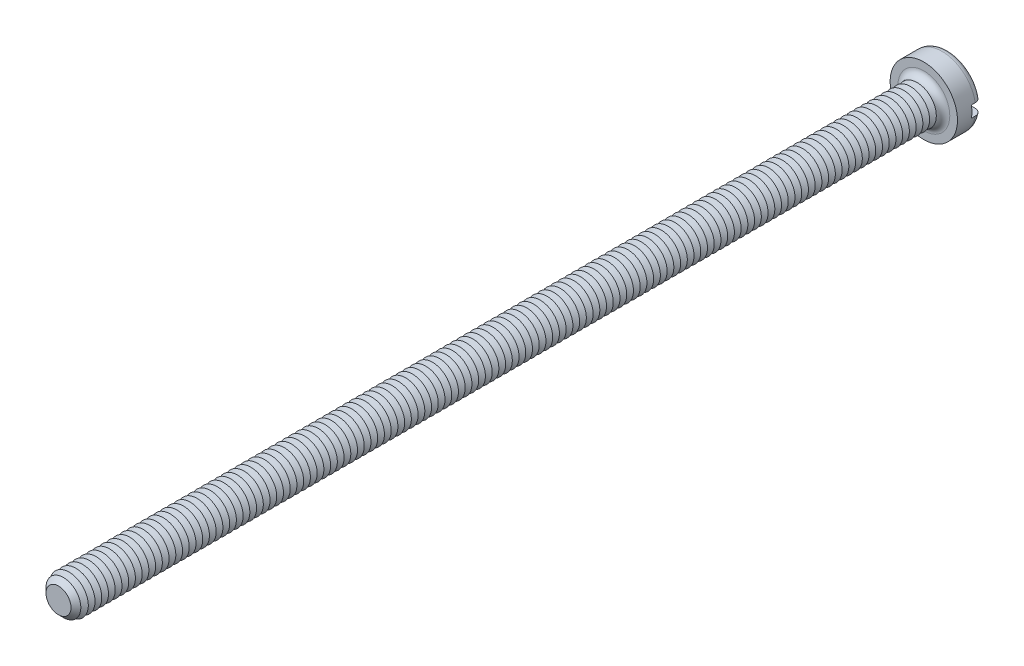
SolidWorks part; units mm, degrees
ref_plane "Front Plane" through (0, 0, 0) normal (0, 0, 1) x (1, 0, 0)
ref_plane "Top Plane" through (0, 0, 0) normal (0, 1, 0) x (1, 0, 0)
ref_plane "Right Plane" through (0, 0, 0) normal (1, 0, 0) x (0, 0, -1)
sketch "Sketch3" plane through (0, 0, 0) normal (0, 0, 1) x (1, 0, 0)
  circle A0 centre (0, 0) radius 3.5
  dimension "D1" = 7
extrude "Boss-Extrude2" add sketch "Sketch3" against normal blind 2.6
sketch "Sketch4" plane through (0, 0, 0) normal (0, 0, 1) x (1, 0, 0)
  circle A0 centre (0, 0) radius 2
  dimension "D1" = 4
extrude "Boss-Extrude3" add sketch "Sketch4" along normal blind 90
fillet "Fillet1" radius 0.7 2 edges at (3.5, 0, -2.6) (2, 0, 0)
chamfer "Chamfer1" distance 0.7 angle 45 1 edges at (2, 0, 90)
sketch "Sketch5" plane through (0, 0, 0) normal (1, 0, 0) x (0, 0, -1)
  line L0 (1.6944, 0) -> (-7.6738, 0) construction
sketch "Sketch6" plane through (0, 0, 0) normal (1, 0, 0) x (0, 0, -1)
  line L0 (-0.7, 2) -> (-1.05, 1.3938)
  line L1 (-1.05, 1.3938) -> (-1.4, 2)
  line L2 (-0.7, 2) -> (-89.3, 2) construction
  line L3 (-1.4, 2) -> (-0.7, 2)
  dimension "D1" = 0.7
revolve "Cut-Revolve1" cut sketch "Sketch6" angle 360 about L0
pattern_linear "LPattern1" count 127 spacing 0.7 along (0, 0, 1) of "Cut-Revolve1"
sketch "Sketch8" plane through (0, 0, -2.6) normal (0, 0, -1) x (-1, 0, 0)
  line L1 (3.5, -0.6) -> (-3.5, -0.6)
  line L2 (3.5, -0.6) -> (3.5, 0.6)
  line L3 (3.5, 0.6) -> (-3.5, 0.6)
  line L4 (-3.5, -0.6) -> (-3.5, 0.6)
  line L5 (3.5, -0.6) -> (-3.5, 0.6) construction
  line L6 (3.5, 0.6) -> (-3.5, -0.6) construction
  point P0 (0, 0)
  dimension "D1" = 7
  dimension "D2" = 1.2
extrude "Cut-Extrude1" cut sketch "Sketch8" against normal blind 1.1
